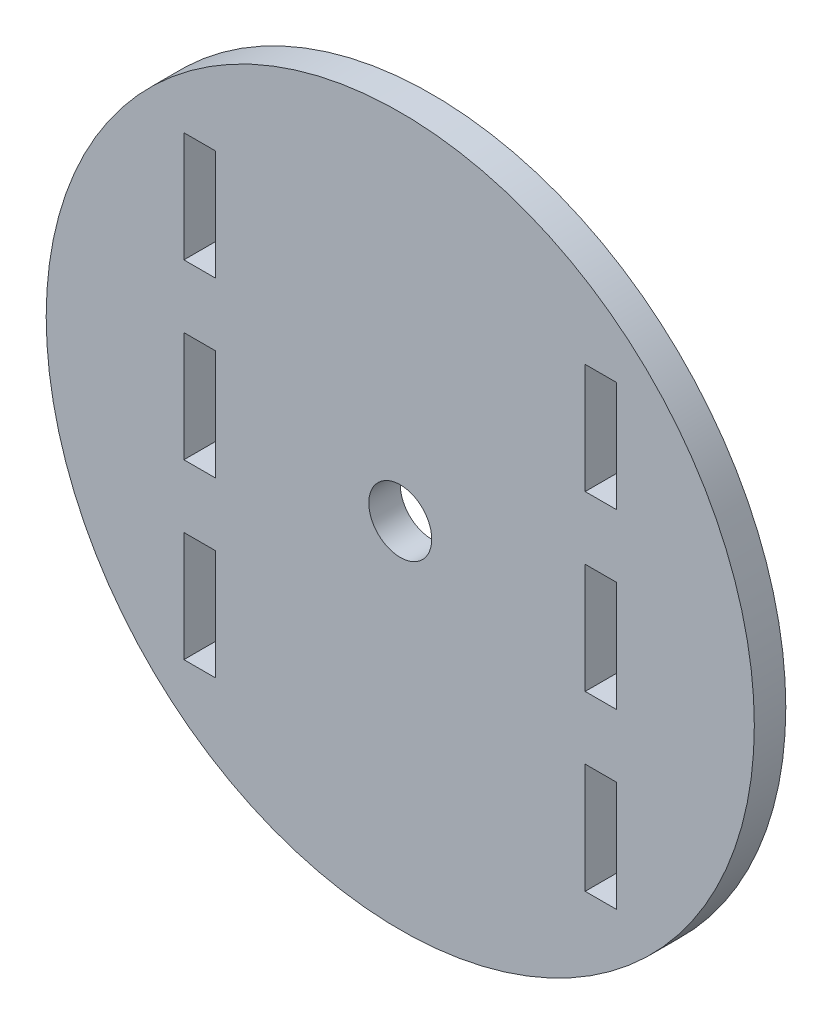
SolidWorks part; units mm, degrees
ref_plane "Front Plane" through (0, 0, 0) normal (0, 0, 1) x (1, 0, 0)
ref_plane "Top Plane" through (0, 0, 0) normal (0, 1, 0) x (1, 0, 0)
ref_plane "Right Plane" through (0, 0, 0) normal (1, 0, 0) x (0, 0, -1)
sketch "Sketch1" plane through (0, 0, 0) normal (0, 0, 1) x (1, 0, 0)
  circle A5 centre (45, 147.5081) radius 45
extrude "Boss-Extrude1" add sketch "Sketch1" along normal blind 4
sketch "Sketch2" plane through (0, 0, 0) normal (0, 0, 1) x (1, 0, 0)
  line L0 (68.5, 176.5081) -> (68.5, 162.5081)
  line L1 (68.5, 140.5081) -> (68.5, 154.5081)
  line L2 (72.5, 132.5081) -> (72.5, 118.5081)
  line L3 (68.5, 132.5081) -> (68.5, 118.5081)
  line L4 (72.5, 176.5081) -> (72.5, 162.5081)
  line L5 (72.5, 140.5081) -> (68.5, 140.5081)
  line L6 (72.5, 154.5081) -> (72.5, 140.5081)
  line L7 (68.5, 154.5081) -> (72.5, 154.5081)
  line L8 (68.5, 132.5081) -> (72.5, 132.5081)
  line L9 (68.5, 162.5081) -> (72.5, 162.5081)
  line L10 (72.5, 118.5081) -> (68.5, 118.5081)
  line L11 (68.5, 176.5081) -> (72.5, 176.5081)
  line L12 (21.5, 176.5081) -> (21.5, 162.5081)
  line L13 (17.5, 162.5081) -> (21.5, 162.5081)
  line L14 (17.5, 175.2581) -> (17.5, 167.7581)
  line L15 (17.5, 118.5081) -> (21.5, 118.5081)
  line L16 (17.5, 176.5081) -> (21.5, 176.5081)
  line L17 (17.5, 140.5081) -> (17.5, 154.5081)
  line L18 (21.5, 132.5081) -> (21.5, 118.5081)
  line L19 (17.5, 132.5081) -> (17.5, 118.5081)
  line L20 (17.5, 162.5081) -> (17.5, 176.5081)
  line L21 (21.5, 140.5081) -> (17.5, 140.5081)
  line L22 (21.5, 154.5081) -> (21.5, 140.5081)
  line L23 (17.5, 154.5081) -> (21.5, 154.5081)
  line L24 (17.5, 132.5081) -> (21.5, 132.5081)
  circle A0 centre (45, 154.9081) radius 0.8
  circle A1 centre (37.6, 147.5081) radius 0.8
  circle A2 centre (45.121, 140.1091) radius 0.8
  circle A3 centre (52.4, 147.5081) radius 0.8
  circle A4 centre (45, 147.5081) radius 4
extrude "Cut-Extrude3" cut sketch "Sketch2" along normal blind 35 contours L0 L9 L4 L11 | L1 L7 L6 L5 | L3 L10 L2 L8 | L12 L13 L20 L16 | L22 L21 L17 L23 | L18 L15 L19 L24 | A4
